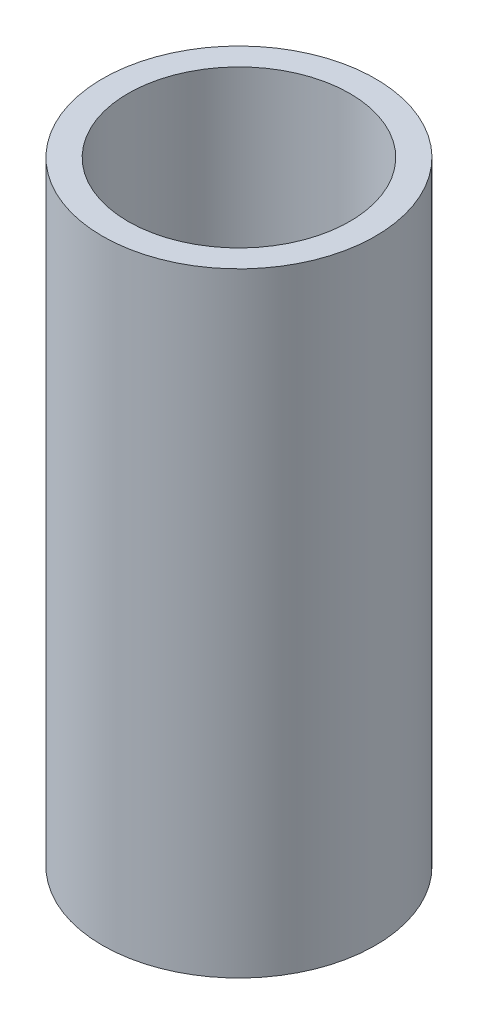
SolidWorks part; units mm, degrees
ref_plane "Front Plane" through (0, 0, 0) normal (0, 0, 1) x (1, 0, 0)
ref_plane "Top Plane" through (0, 0, 0) normal (0, 1, 0) x (1, 0, 0)
ref_plane "Right Plane" through (0, 0, 0) normal (1, 0, 0) x (0, 0, -1)
sketch "Sketch1" plane through (0, 0, 0) normal (0, 1, 0) x (1, 0, 0)
  circle A0 centre (0, 0) radius 3.25
  circle A1 centre (0, 0) radius 4
  dimension "D1" = 6.5
  dimension "D2" = 8
extrude "Extrude1" add sketch "Sketch1" along normal blind 18
